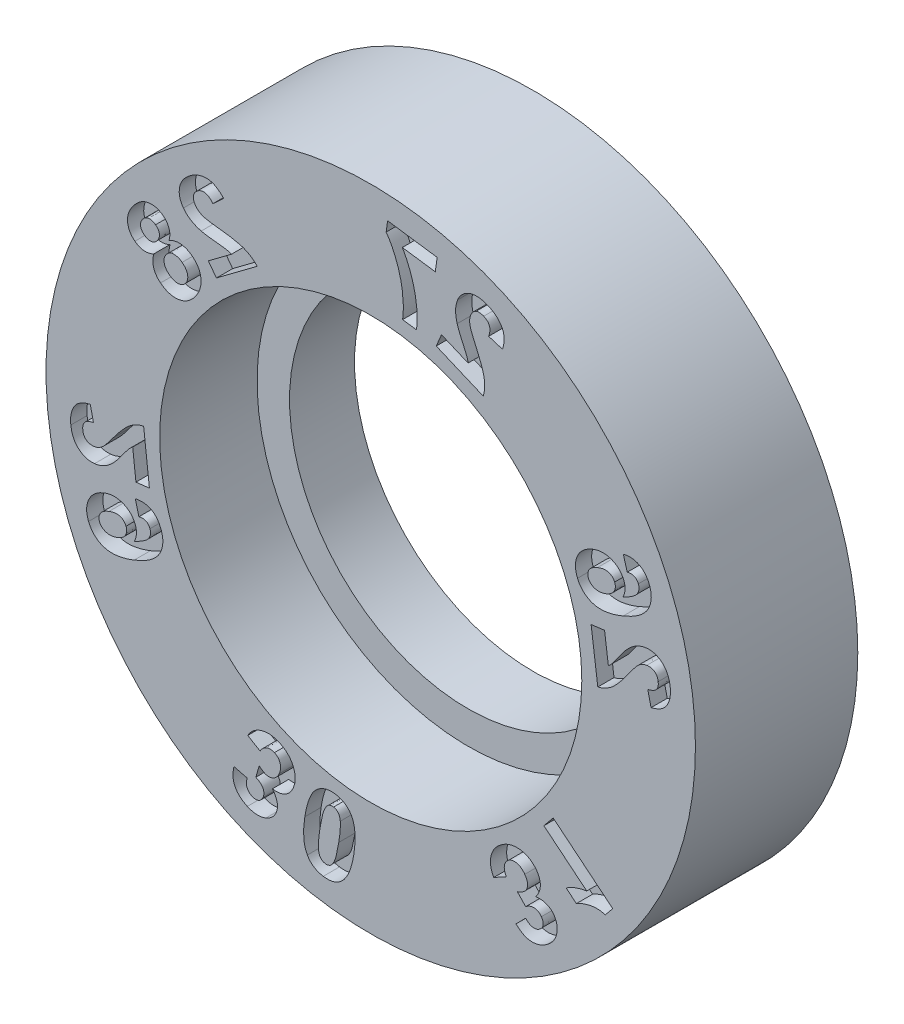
SolidWorks part; units mm, degrees
ref_plane "Front Plane" through (0, 0, 0) normal (0, 0, 1) x (1, 0, 0)
ref_plane "Top Plane" through (0, 0, 0) normal (0, 1, 0) x (1, 0, 0)
ref_plane "Right Plane" through (0, 0, 0) normal (1, 0, 0) x (0, 0, -1)
imported_body "Imported1"
other "DeleteFace1"
sketch "Sketch1" plane through (0, 0, 0) normal (0, 0, 1) x (1, 0, 0)
  line L0 (0, 0) -> (0, 11.8635) construction
  line L1 (0, 0) -> (10.2741, 5.9318) construction
  line L2 (0, 0) -> (10.2741, -5.9318) construction
  line L3 (0, 0) -> (0, -11.8635) construction
  line L4 (0, 0) -> (-10.2741, -5.9318) construction
  line L5 (0, 0) -> (-10.2741, 5.9318) construction
  circle A0 centre (0, 0) radius 7.0035 construction
  text T0 "26    27    28    29    30    31" font "Arial" height 2.37
  point P12 (0, 0)
  dimension "D1" = 6
extrude "Cut-Extrude1" cut sketch "Sketch1" against normal blind 0.5
